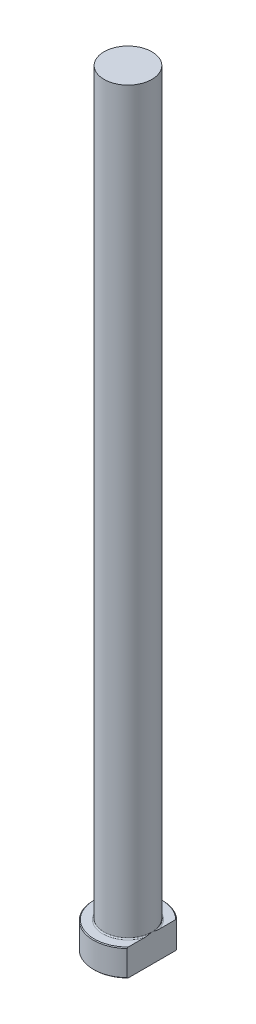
SolidWorks part; units mm, degrees
ref_plane "Front Plane" through (0, 0, 0) normal (0, 0, 1) x (1, 0, 0)
ref_plane "Top Plane" through (0, 0, 0) normal (0, 1, 0) x (1, 0, 0)
ref_plane "Right Plane" through (0, 0, 0) normal (1, 0, 0) x (0, 0, -1)
sketch "Sketch1" plane through (0, 0, 0) normal (0, 0, 1) x (1, 0, 0)
  line L0 (0, 259.9588) -> (0, -15.1925) construction
  line L1 (0, 0) -> (-9, 0)
  line L2 (-9, 0) -> (-9, 7)
  line L3 (-9, 7) -> (-6.25, 7)
  line L4 (-6.25, 7) -> (-6.25, 200)
  line L5 (-6.25, 200) -> (0, 200)
  line L6 (0, 200) -> (0, 0)
  dimension "L" = 200
  dimension "H" = 18
  dimension "T" = 7
  dimension "D" = 12.5
revolve "Revolve1" add sketch "Sketch1" angle 360 about L0
chamfer "Chamfer1" distance 0.2 angle 45 2 edges at (0, 7, 9) (0, 0, 9)
fillet "Fillet1" radius 0.3 1 edges at (0, 7, 6.25)
sketch "Sketch2" plane through (0, 0, 0) normal (0, 1, 0) x (1, 0, 0)
  line L0 (6.25, 6.4759) -> (6.25, -6.4759)
  circle A0 centre (0, 0) radius 9 construction
  arc A1 (6.25, -6.4759) -> (6.25, 6.4759) centre (0, 0) ccw
  circle A2 centre (0, 0) radius 6.25 construction
extrude "KEY" cut sketch "Sketch2" along normal through all
